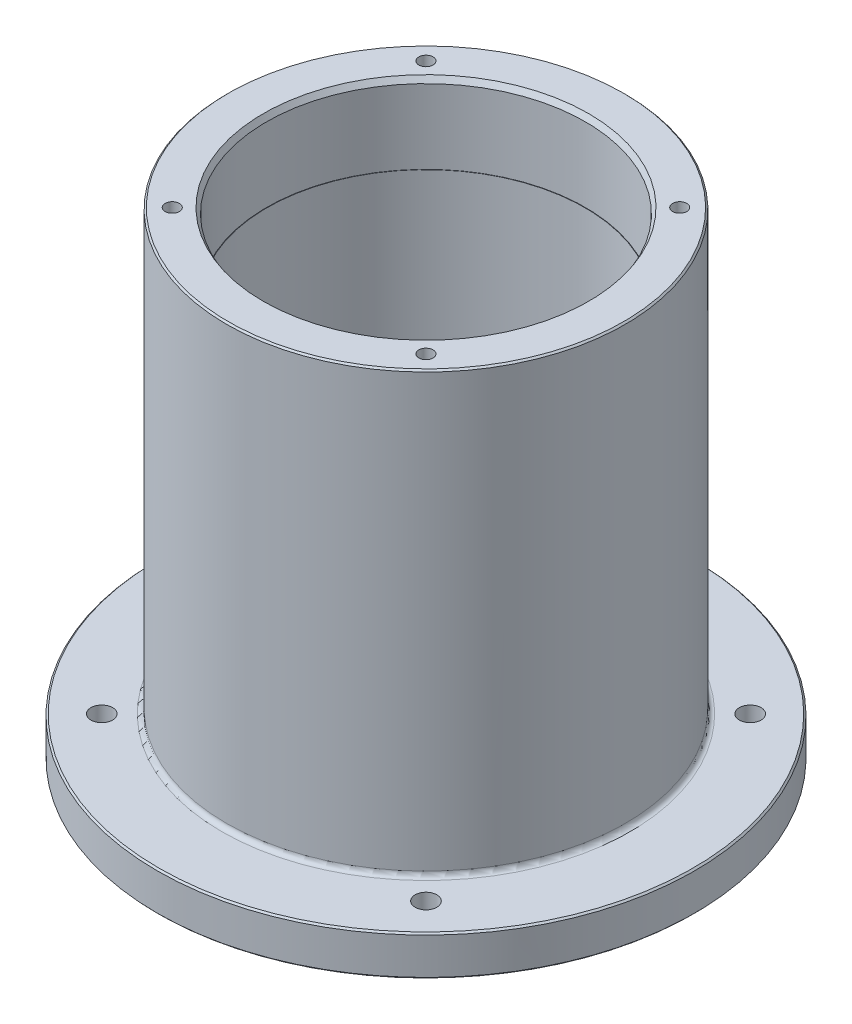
SolidWorks part; units mm, degrees
ref_plane "Front" through (0, 0, 0) normal (0, 0, 1) x (1, 0, 0)
ref_plane "Top" through (0, 0, 0) normal (0, 1, 0) x (1, 0, 0)
ref_plane "Right" through (0, 0, 0) normal (1, 0, 0) x (0, 0, -1)
sketch "Sketch1" plane through (0, 0, 0) normal (0, 1, 0) x (1, 0, 0)
  circle A0 centre (0, 0) radius 57.785
  dimension "D1" = 115.57
extrude "Body" add sketch "Sketch1" against normal blind 101.6
sketch "Sketch2" plane through (0, 0, 0) normal (0, 1, 0) x (-1, 0, 0)
  circle A1 centre (0, 0) radius 63.5
  circle A2 centre (0, 0) radius 63.5
  dimension "D1" = 5.715
extrude "Flange" add sketch "Sketch2" along normal blind 9.525
sketch "Sketch3" plane through (0, -101.6, 0) normal (0, -1, 0) x (1, 0, 0)
  circle A0 centre (0, 0) radius 5.4769
  dimension "D1" = 10.9537
extrude "MagWell" cut sketch "Sketch3" against normal blind 20.6375
sketch "Sketch6" plane through (0, -101.6, 0) normal (0, -1, 0) x (1, 0, 0)
  circle A0 centre (0, 0) radius 5.7544
  dimension "D1" = 11.5087
extrude "Cut-Extrude1" cut sketch "Sketch6" against normal blind 25.4
sketch "Sketch7" plane through (0, 9.525, 0) normal (0, 1, 0) x (-1, 0, 0)
  circle A0 centre (0, 0) radius 17.4625
  circle A1 centre (0, 0) radius 7.1437
  dimension "D1" = 34.925
  dimension "D2" = 14.2875
extrude "Big Magnet Well" cut sketch "Sketch7" against normal blind 104.775
sketch "Sketch8" plane through (0, 9.525, 0) normal (0, 1, 0) x (-1, 0, 0)
  circle A0 centre (0, 0) radius 16.002
extrude "Relief Cut" cut sketch "Sketch8" against normal blind 79.375
sketch "Sketch10" plane through (0, 0, 0) normal (0, 0, 1) x (1, 0, 0)
  line L0 (-2.6376, -69.85) -> (-2.7598, -69.7766)
  line L1 (0, -71.4349) -> (-2.4487, -69.9635)
  line L2 (3.302, -69.85) -> (1.6891, -69.85) construction
  line L3 (0, -71.4349) -> (0, -67.7418) construction
  line L4 (-2.4487, -69.9635) -> (-2.6376, -69.85)
  line L5 (0, -71.4349) -> (0, -69.85)
  line L6 (7.2136, -73.025) -> (-9.8044, -73.025) construction
  line L7 (-2.7598, -69.7766) -> (0, -69.7766)
  line L8 (0, -69.85) -> (0, -69.7766)
  dimension "D1" = 3.175
  dimension "D2" = 59
revolve "Cut-Revolve1" cut sketch "Sketch10" angle 360 about L3
sketch "Sketch11" plane through (0, -101.6, 0) normal (0, -1, 0) x (1, 0, 0)
  circle A0 centre (0, 0) radius 7.9375
  dimension "D1" = 15.875
extrude "Cut-Extrude5" cut sketch "Sketch11" against normal blind 4.318
hole_wizard "#6-32BushRet" positions "Sketch31" profile "Sketch30" legacy
sketch "Sketch31" plane through (0, -101.6, 0) normal (0, -1, 0) x (1, 0, 0)
  point P0 (12.7, 0.0035)
  dimension "D1" = 12.7
sketch "Sketch30" plane through (12.7, -101.6, 0.0035) normal (1, 0, 0) x (0, 0, -1)
  line L0 (0, 0) -> (0, 4.7625)
  line L1 (0, 4.7625) -> (1.3525, 3.9498)
  line L2 (1.3525, 3.9498) -> (1.3525, 0.0025)
  line L3 (1.3525, 0.0025) -> (1.3525, 0)
  line L4 (1.3525, 0) -> (0, 0)
pattern_circular "6-32CirPat" count 4 every 90 about axis through (0, 0, 0) along (0, 1, 0) of "#6-32BushRet"
sketch "Sketch15" plane through (0, 9.525, 0) normal (0, 1, 0) x (-1, 0, 0)
  circle A0 centre (0, 0) radius 25.3365
  dimension "D1" = 50.673
extrude "Motor Well" cut sketch "Sketch15" against normal blind 65.0875
sketch "Sketch17" plane through (0, -55.5625, 0) normal (0, 1, 0) x (-1, 0, 0)
  line L0 (0, 0) -> (-27.9019, 0) construction
  circle A1 centre (0, -21.4312) radius 1.3462
  circle A2 centre (0, 21.4312) radius 1.3462
  circle A3 centre (-21.4312, 0) radius 1.3462
  circle A4 centre (21.4312, 0) radius 1.3462
  dimension "D1" = 21.4312
  dimension "D2" = 2.6924
  dimension "D3" = 2.6924
  dimension "D4" = 21.4312
extrude "#6-32MotorMount" cut sketch "Sketch17" against normal blind 6.35
sketch "Sketch24" plane through (0, 9.525, 0) normal (0, 1, 0) x (-1, 0, 0)
  line L0 (-41.275, 3.175) -> (-16.4299, 3.175)
  line L1 (-16.4299, -3.175) -> (-41.275, -3.175)
  line L2 (-16.4299, -3.175) -> (-16.4299, 3.175)
  line L3 (-41.275, -3.175) -> (-41.275, 3.175)
  dimension "D2" = 6.35
extrude "Cut-Extrude12" cut sketch "Sketch24" against normal blind 25.4
ref_plane "Plane1" through (0, 6.35, 0) normal (-1, 0, 0) x (0, 0, 1)
sketch "Sketch40" plane through (-45.0528, 9.525, 28.7872) normal (0, 1, 0) x (-1, 0, 0)
  line L0 (-45.0528, -28.7872) -> (-2.0061, -42.3598) construction
  line L1 (-45.0528, -28.7872) -> (7.2254, -28.7872) construction
  line L2 (-45.0528, -28.7872) -> (-128.2725, -69.8205) construction
  line L3 (-45.0528, -28.7872) -> (-2.0061, -15.2146) construction
  line L4 (-45.0528, -28.7872) -> (-14.7022, -104.3948) construction
  arc A0 (-8.818, -40.212) -> (-8.818, -17.3623) centre (-45.0528, -28.7872) ccw
  arc A1 (4.8058, -44.5075) -> (4.8058, -13.0668) centre (-45.0528, -28.7872) ccw
  arc A2 (-8.818, -40.212) -> (4.8058, -44.5075) centre (-2.0061, -42.3598) ccw
  arc A3 (-2.0061, -42.3598) -> (-2.0061, -15.2146) centre (-45.0528, -28.7872) ccw construction
  arc A4 (-8.818, -17.3623) -> (4.8058, -13.0668) centre (-2.0061, -15.2146) cw
  circle A6 centre (-85.5351, -48.7479) radius 7.1374
  dimension "D2" = 171.253
  dimension "D3" = 85.625
  dimension "D1" = 14.2748
  dimension "Slot CL Radius" = 45.1358
  dimension "Slot Width" = 7.1425
  dimension "Angle" = 35
extrude "VentSlotCurved " cut sketch "Sketch40" against normal blind 92.075
ref_plane "Plane3" through (0, -101.6, 0) normal (-1, 0, 0) x (0, 0, 1)
sketch "Sketch43" plane through (0, -101.6, 0) normal (-1, 0, 0) x (0, 0, 1)
  line L0 (54.5527, 6.098) -> (57.1246, 5.7728)
  line L2 (57.1246, 11.577) -> (54.5625, 11.3528)
  line L3 (54.3306, 11.0998) -> (54.3306, 6.35)
  line L4 (0, 50) -> (0, 7.3152) construction
  line L5 (0, 0) -> (0, 101.6) construction
  line L6 (54.3306, 8.7249) -> (59.0306, 8.7249) construction
  line L7 (0, 0) -> (22.8473, 0) construction
  line L8 (57.1246, 5.7728) -> (58.1555, 5.6425)
  line L9 (57.1246, 11.577) -> (58.1555, 11.6672)
  line L10 (58.1555, 5.6425) -> (58.1555, 11.6672)
  arc A0 (54.3306, 6.35) -> (54.5527, 6.098) centre (54.5846, 6.35) ccw
  arc A1 (54.3306, 11.0998) -> (54.5625, 11.3528) centre (54.5846, 11.0998) cw
  dimension "D1" = 0.254
  dimension "D2" = 0.254
  dimension "D3" = 4.7498
  dimension "D4" = 2.794
  dimension "D5" = 54.3306
  dimension "D6" = 5
  dimension "D7" = 6.35
revolve "O-Ring#2-244" cut sketch "Sketch43" angle 360 about L4
chamfer "LeadInChamfer" distance 1.5875 angle 45 1 edges at (0, -101.6, 57.785)
sketch "Sketch48" plane through (0, -76.2, 0) normal (0, -1, 0) x (1, 0, 0)
  circle A0 centre (0, 0) radius 2.5781
  dimension "D1" = 5.1562
extrude "Cut-Extrude13" cut sketch "Sketch48" against normal blind 3.175
sketch "Sketch51" plane through (0, 9.525, 0) normal (0, 1, 0) x (-1, 0, 0)
  circle A0 centre (0, 0) radius 42.799
  circle A1 centre (0, 0) radius 63.5 construction
  circle A2 centre (0, 0) radius 63.5
  dimension "D1" = 85.598
extrude "od cut away1" cut sketch "Sketch51" against normal through all
sketch "Sketch52" plane through (0, 9.525, 0) normal (0, 1, 0) x (-1, 0, 0)
  circle A0 centre (0, 0) radius 31.75
  circle A1 centre (0, 0) radius 42.799 construction
  circle A2 centre (0, 0) radius 42.799
  dimension "D1" = 63.5
extrude "od cut 2" cut sketch "Sketch52" against normal blind 95.25
sketch "Sketch53" plane through (0, -101.6, 0) normal (0, -1, 0) x (1, 0, 0)
  circle A0 centre (0, 0) radius 22.1996
  circle A1 centre (0, 0) radius 42.799 construction
  circle A2 centre (0, 0) radius 42.799
  dimension "D1" = 44.3992
extrude "face cut" cut sketch "Sketch53" against normal blind 9.525
sketch "Sketch54" plane through (0, 9.525, 0) normal (0, 1, 0) x (-1, 0, 0)
  circle A0 centre (0, 0) radius 36.0924
  circle A1 centre (0, 0) radius 25.4
extrude "tube top" cut sketch "Sketch54" against normal up to surface (25.4 mm away)
chamfer "od edges" distance 0.254 angle 45 4 edges at (0, -15.875, -31.75) (0, -85.725, 42.799) (0, -92.075, -42.799) (0, -101.6, -22.1996)
ref_plane "Plane4" through (0, -92.075, 0) normal (-1, 0, 0) x (0, 0, -1)
sketch "Sketch56" plane through (0, -92.075, 0) normal (-1, 0, 0) x (0, 0, -1)
  line L0 (21.0726, 6.2514) -> (22.1996, 6.35)
  line L1 (22.1996, 6.35) -> (22.1996, 3.7906)
  line L2 (22.1996, 3.7906) -> (21.0726, 3.8892)
  line L3 (20.8407, 4.1422) -> (20.8407, 5.9984)
  line L4 (0, 49.9999) -> (0, -49.9999) construction
  line L5 (22.1996, 0) -> (22.1996, 9.271) construction
  line L7 (22.1996, 9.525) -> (-22.1996, 9.525) construction
  arc A0 (21.0726, 3.8892) -> (20.8407, 4.1422) centre (21.0947, 4.1422) cw
  arc A1 (20.8407, 5.9984) -> (21.0726, 6.2514) centre (21.0947, 5.9984) cw
  dimension "D3" = 0.254
  dimension "D4" = 0.254
  dimension "D1" = 1.8561
  dimension "D2" = 1.3589
  dimension "D5" = 2.5594
  dimension "D6" = 85
  dimension "D7" = 85
  dimension "D8" = 3.175
revolve "Groove for AS 568-030, O-Ring1" cut sketch "Sketch56"
sketch "Sketch57" plane through (0, -92.075, 0) normal (0, -1, 0) x (1, 0, 0)
  line L0 (0, 0) -> (47.6834, 0) construction
  line L1 (0, 0) -> (33.1907, -33.1907) construction
  line L2 (7.816, -7.816) -> (-42.2126, 42.2126) construction
  line L3 (0, 0) -> (-36.7614, -36.7614) construction
  line L4 (0, 0) -> (32.4999, 32.4999) construction
  circle A0 centre (0, 0) radius 36.5125 construction
  circle A1 centre (25.8182, 25.8182) radius 1.7272
  circle A2 centre (-25.8182, 25.8182) radius 1.7272
  circle A3 centre (-25.8182, -25.8182) radius 1.7272
  circle A4 centre (25.8182, -25.8182) radius 1.7272
  dimension "D1" = 73.025
  dimension "D5" = 3.4544
  dimension "D6" = 3.4544
  dimension "D7" = 3.4544
  dimension "D8" = 3.4544
  dimension "D2" = 45
  dimension "D3" = 90
  dimension "D4" = 90
extrude "mount holes" cut sketch "Sketch57" against normal through all
sketch "Sketch58" plane through (0, -15.875, 0) normal (0, 1, 0) x (-1, 0, 0)
  line L0 (0, 0) -> (0, 44.2468) construction
  line L1 (0, 0) -> (0, -40.1447) construction
  line L2 (0, 0) -> (-25.8182, 25.8182) construction
  line L3 (0, 0) -> (34.4297, -34.4297) construction
  line L4 (0, 0) -> (42.4561, 42.4561) construction
  line L5 (0, 0) -> (-35.1282, -35.1282) construction
  circle A0 centre (0, 0) radius 28.575 construction
  circle A1 centre (-20.2056, -20.2056) radius 1.1303
  circle A2 centre (-20.2056, 20.2056) radius 1.1303
  circle A3 centre (20.2056, 20.2056) radius 1.1303
  circle A4 centre (20.2056, -20.2056) radius 1.1303
  dimension "D1" = 57.15
  dimension "D2" = 2.2606
  dimension "D3" = 2.2606
  dimension "D4" = 2.2606
  dimension "D5" = 2.2606
extrude "Cut-Extrude17" cut sketch "Sketch58" against normal blind 19.05
fillet "Fillet1" radius 0.762 1 edges at (0, -85.725, 31.75)
sketch "Sketch59" plane through (0, 9.525, 0) normal (0, 1, 0) x (-1, 0, 0)
  circle A0 centre (0, 0) radius 25.4
extrude "Cut-Extrude18" cut sketch "Sketch59" against normal blind 38.1
chamfer "Chamfer1" distance 0.508 angle 60 1 edges at (0, -15.875, -25.4)
